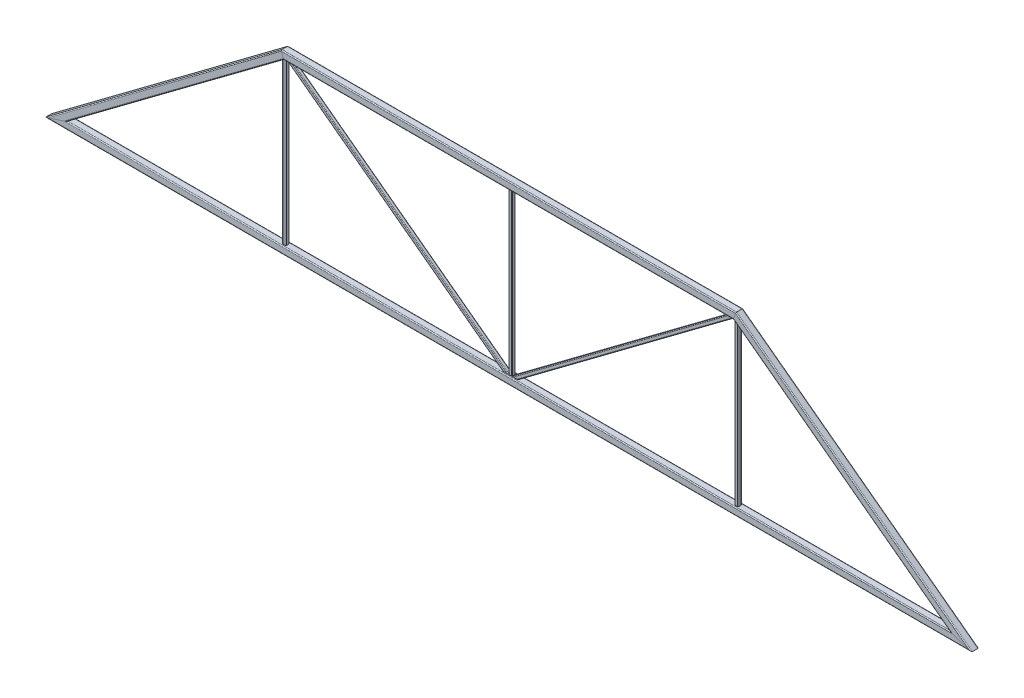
SolidWorks part; units mm, degrees
ref_plane "Alzado" through (0, 0, 0) normal (0, 0, 1) x (1, 0, 0)
ref_plane "Planta" through (0, 0, 0) normal (0, 1, 0) x (1, 0, 0)
ref_plane "Vista lateral" through (0, 0, 0) normal (1, 0, 0) x (0, 0, -1)
sketch "Croquis1" plane through (0, 0, 0) normal (0, 0, 1) x (1, 0, 0)
  line L0 (-5000, 0) -> (5000, 0)
  line L1 (-5000, 0) -> (-2500, 1868.298)
  line L2 (-2500, 1868.298) -> (2500, 1868.298)
  line L3 (2500, 1868.298) -> (5000, 0)
  line L4 (0, 0) -> (2500, 1868.298)
  line L5 (0, 0) -> (-2500, 1868.298)
  line L6 (-2500, 1868.298) -> (-2500, 0)
  line L7 (2500, 1868.298) -> (2500, 0)
  line L8 (0, 0) -> (0, 1868.298)
  dimension "D1" = 10000
other "Miembro estructural1"
ref_plane "Plano1" through (-5000, 0, 0) normal (1, 0, 0) x (0, 1, 0)
sketch "Sketch1" plane through (-5000, 0, 0) normal (1, 0, 0) x (0, 1, 0)
  line L0 (-30, -35) -> (30, -35)
  line L1 (-35, -30) -> (-35, 30)
  line L2 (30, 35) -> (-30, 35)
  line L3 (35, 30) -> (35, -30)
  line L4 (-30, -40) -> (30, -40)
  line L5 (-40, -30) -> (-40, 30)
  line L6 (30, 40) -> (-30, 40)
  line L7 (40, 30) -> (40, -30)
  arc A0 (40, 30) -> (30, 40) centre (30, 30) ccw
  arc A1 (30, -40) -> (40, -30) centre (30, -30) ccw
  arc A2 (-40, -30) -> (-30, -40) centre (-30, -30) ccw
  arc A3 (-30, 40) -> (-40, 30) centre (-30, 30) ccw
  arc A4 (-30, 35) -> (-35, 30) centre (-30, 30) ccw
  arc A5 (35, 30) -> (30, 35) centre (30, 30) ccw
  arc A6 (30, -35) -> (35, -30) centre (30, -30) ccw
  arc A7 (-35, -30) -> (-30, -35) centre (-30, -30) ccw
  point P0 (-40, 0)
  point P1 (40, 0)
  point P2 (0, 40)
  point P3 (0, -40)
  point P4 (0, 0)
  point P5 (-40, -40)
  point P6 (40, -40)
  point P7 (40, 40)
  point P8 (-40, 40)
  point P33 (0, 0)
  dimension "D1" = 10
  dimension "Thickness" = 5
  dimension "V_leg" = 80
other "Miembro estructural2"
ref_plane "Plano2" through (-2500, 1868.298, 0) normal (0, -1, 0) x (1, 0, 0)
sketch "Sketch11" plane through (-2500, 1868.298, 0) normal (0, -1, 0) x (1, 0, 0)
  line L0 (-12, -16) -> (12, -16)
  line L1 (-16, -12) -> (-16, 12)
  line L2 (12, 16) -> (-12, 16)
  line L3 (16, 12) -> (16, -12)
  line L4 (-12, -20) -> (12, -20)
  line L5 (-20, -12) -> (-20, 12)
  line L6 (12, 20) -> (-12, 20)
  line L7 (20, 12) -> (20, -12)
  arc A0 (20, 12) -> (12, 20) centre (12, 12) ccw
  arc A1 (12, -20) -> (20, -12) centre (12, -12) ccw
  arc A2 (-20, -12) -> (-12, -20) centre (-12, -12) ccw
  arc A3 (-12, 20) -> (-20, 12) centre (-12, 12) ccw
  arc A4 (-12, 16) -> (-16, 12) centre (-12, 12) ccw
  arc A5 (16, 12) -> (12, 16) centre (12, 12) ccw
  arc A6 (12, -16) -> (16, -12) centre (12, -12) ccw
  arc A7 (-16, -12) -> (-12, -16) centre (-12, -12) ccw
  point P0 (-20, 0)
  point P1 (20, 0)
  point P2 (0, 20)
  point P3 (0, -20)
  point P4 (0, 0)
  point P5 (-20, -20)
  point P6 (20, -20)
  point P7 (20, 20)
  point P8 (-20, 20)
  point P33 (0, 0)
  dimension "D1" = 8
  dimension "Thickness" = 4
  dimension "V_leg" = 40
other "Miembro estructural3"
ref_plane "Plano3" through (0, 0, 0) normal (0, 1, 0) x (-1, 0, 0)
sketch "Sketch12" plane through (0, 0, 0) normal (0, 1, 0) x (-1, 0, 0)
  line L0 (-12, -16) -> (12, -16)
  line L1 (-16, -12) -> (-16, 12)
  line L2 (12, 16) -> (-12, 16)
  line L3 (16, 12) -> (16, -12)
  line L4 (-12, -20) -> (12, -20)
  line L5 (-20, -12) -> (-20, 12)
  line L6 (12, 20) -> (-12, 20)
  line L7 (20, 12) -> (20, -12)
  arc A0 (20, 12) -> (12, 20) centre (12, 12) ccw
  arc A1 (12, -20) -> (20, -12) centre (12, -12) ccw
  arc A2 (-20, -12) -> (-12, -20) centre (-12, -12) ccw
  arc A3 (-12, 20) -> (-20, 12) centre (-12, 12) ccw
  arc A4 (-12, 16) -> (-16, 12) centre (-12, 12) ccw
  arc A5 (16, 12) -> (12, 16) centre (12, 12) ccw
  arc A6 (12, -16) -> (16, -12) centre (12, -12) ccw
  arc A7 (-16, -12) -> (-12, -16) centre (-12, -12) ccw
  point P0 (-20, 0)
  point P1 (20, 0)
  point P2 (0, 20)
  point P3 (0, -20)
  point P4 (0, 0)
  point P5 (-20, -20)
  point P6 (20, -20)
  point P7 (20, 20)
  point P8 (-20, 20)
  point P33 (0, 0)
  dimension "D1" = 8
  dimension "Thickness" = 4
  dimension "V_leg" = 40
other "Recortar/Extender1"
other "Recortar/Extender2"
other "Recortar/Extender3"
other "Recortar/Extender4"
other "Recortar/Extender5"
other "Recortar/Extender6"
other "Recortar/Extender7"
other "Recortar/Extender8"
other "Recortar/Extender9"
